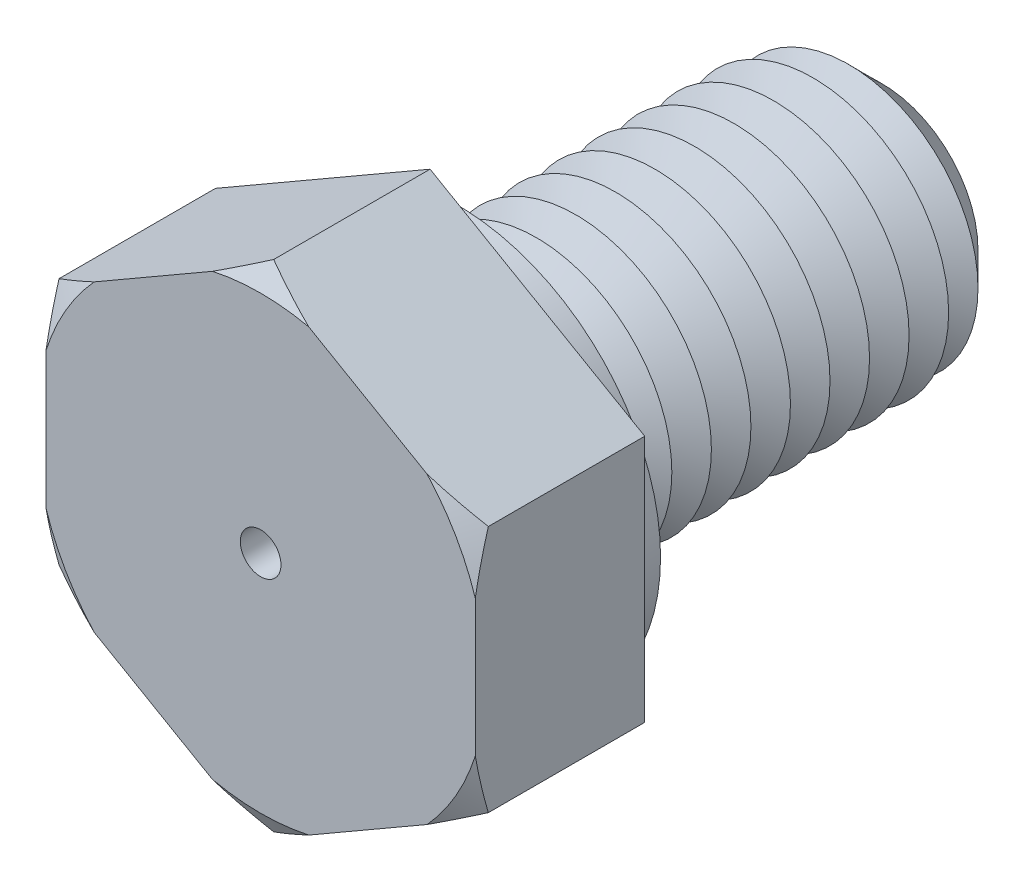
SolidWorks part; units mm, degrees
ref_plane "Front Plane" through (0, 0, 0) normal (0, 0, 1) x (1, 0, 0)
ref_plane "Top Plane" through (0, 0, 0) normal (0, 1, 0) x (1, 0, 0)
ref_plane "Right Plane" through (0, 0, 0) normal (1, 0, 0) x (0, 0, -1)
sketch "Sketch2" plane through (0, 0, 0) normal (0, 0, 1) x (1, 0, 0)
  line L1 (0, 10.9697) -> (-9.5, 5.4848)
  line L2 (-9.5, 5.4848) -> (-9.5, -5.4848)
  line L3 (-9.5, -5.4848) -> (0, -10.9697)
  line L4 (0, -10.9697) -> (9.5, -5.4848)
  line L5 (9.5, -5.4848) -> (9.5, 5.4848)
  line L6 (9.5, 5.4848) -> (0, 10.9697)
  circle A0 centre (0, 0) radius 9.5 construction
  dimension "D1" = 19
extrude "Boss-Extrude1" add sketch "Sketch2" along normal blind 7.5
sketch "Sketch3" plane through (0, 0, 0) normal (0, 0, -1) x (-1, 0, 0)
  circle A0 centre (0, 0) radius 6
  dimension "D1" = 12
extrude "Boss-Extrude2" add sketch "Sketch3" along normal blind 20
sketch "Sketch4" plane through (0, 0, 0) normal (0, 0, -1) x (-1, 0, 0)
  circle A0 centre (0, 0) radius 9
  dimension "D1" = 18
extrude "Boss-Extrude3" add sketch "Sketch4" along normal blind 1.2
sketch "Sketch5" plane through (0, 0, 0) normal (1, 0, 0) x (0, 0, -1)
  line L0 (-3.2117, 0) -> (6.3192, 0) construction
chamfer "Chamfer1" distance 1.75 angle 45 1 edges at (-6, 0, -20)
sketch "Sketch6" plane through (0, 0, 0) normal (1, 0, 0) x (0, 0, -1)
  line L0 (1.2, 6) -> (2.075, 4.4845)
  line L1 (2.075, 4.4845) -> (2.95, 6)
  line L2 (18.25, 6) -> (1.2, 6) construction
  line L3 (2.95, 6) -> (1.2, 6)
  dimension "D1" = 1.75
revolve "Cut-Revolve1" cut sketch "Sketch6" angle 360 about L0
pattern_linear "LPattern1" count 10 spacing 1.75 along (0, 0, -1) of "Cut-Revolve1"
sketch "Sketch7" plane through (0, 0, 0) normal (1, 0, 0) x (0, 0, -1)
  line L0 (-7.5, 10.9697) -> (-7.5, 9.9697)
  line L1 (-7.5, 5.4848) -> (-7.5, 10.9697) construction
  line L2 (-7.5, 9.9697) -> (-6.9226, 10.9697)
  line L3 (-7.5, 10.9697) -> (0, 10.9697) construction
  line L4 (-6.9226, 10.9697) -> (-7.5, 10.9697)
  dimension "D1" = 1
  dimension "D2" = 30
revolve "Cut-Revolve2" cut sketch "Sketch7" angle 360 about L0
sketch "Sketch8" plane through (0, 0, 7.5) normal (0, 0, 1) x (1, 0, 0)
  circle A0 centre (0, 0) radius 0.9
  dimension "D1" = 1.8
extrude "Cut-Extrude1" cut sketch "Sketch8" against normal up to surface (27.5 mm away)
